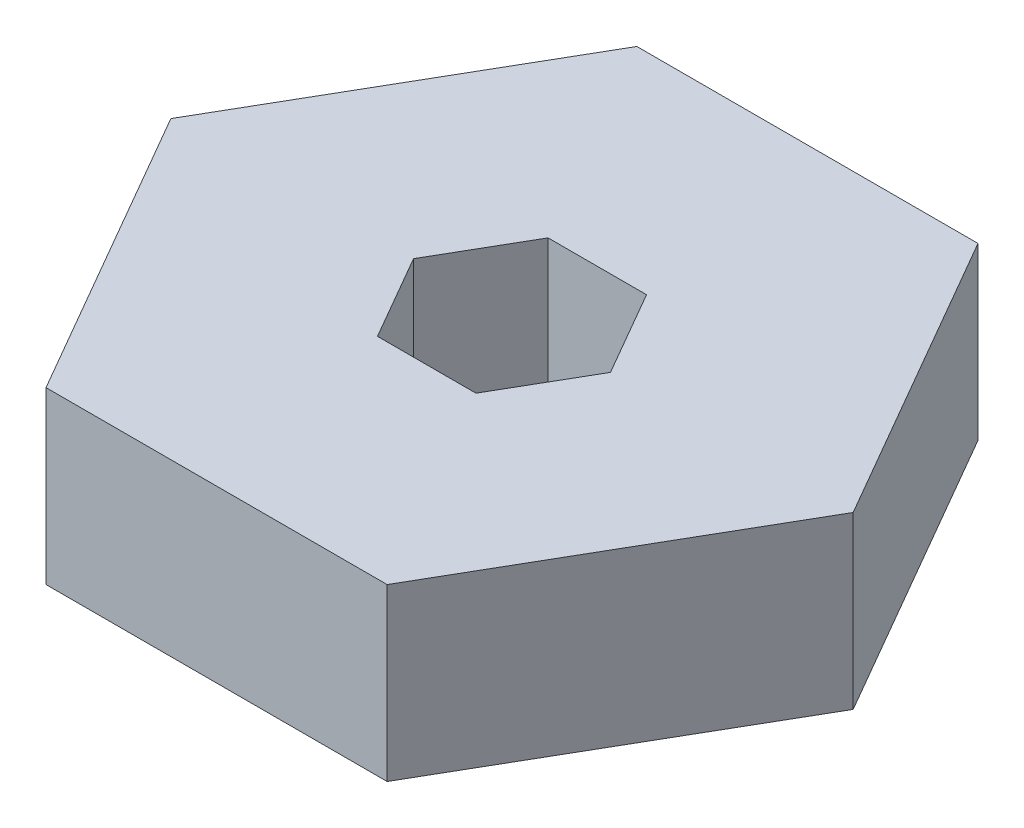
SolidWorks part; units mm, degrees
ref_plane "Front Plane" through (0, 0, 0) normal (0, 0, 1) x (1, 0, 0)
ref_plane "Top Plane" through (0, 0, 0) normal (0, 1, 0) x (1, 0, 0)
ref_plane "Right Plane" through (0, 0, 0) normal (1, 0, 0) x (0, 0, -1)
sketch "Sketch2" plane through (0, 0, 0) normal (0, 1, 0) x (1, 0, 0)
  line L1 (11.547, 0) -> (5.7735, 10)
  line L2 (5.7735, 10) -> (-5.7735, 10)
  line L3 (-5.7735, 10) -> (-11.547, 0)
  line L4 (-11.547, 0) -> (-5.7735, -10)
  line L5 (-5.7735, -10) -> (5.7735, -10)
  line L6 (5.7735, -10) -> (11.547, 0)
  line L7 (40, 0) -> (20, 34.641)
  line L8 (20, 34.641) -> (-20, 34.641)
  line L9 (-20, 34.641) -> (-40, 0)
  line L10 (-40, 0) -> (-20, -34.641)
  line L11 (-20, -34.641) -> (20, -34.641)
  line L12 (20, -34.641) -> (40, 0)
  circle A0 centre (0, 0) radius 10 construction
  circle A1 centre (0, 0) radius 34.641 construction
extrude "Boss-Extrude1" add sketch "Sketch2" along normal blind 20
sketch "Sketch27" plane through (30, 0, 17.3205) normal (0.866, 0, 0.5) x (0.5, 0, -0.866)
  text T0 "2"
sketch "Sketch28" plane through (8.6603, 0, 5) normal (-0.866, 0, -0.5) x (-0.5, 0, 0.866)
  line L0 (0, 0) -> (0, 20) construction
  line L1 (5.7735, 0) -> (-5.7735, 0) construction
  line L2 (5.7735, 20) -> (-5.7735, 20) construction
  line L3 (0, 10) -> (5.7735, 10) construction
  line L4 (5.7735, 20) -> (5.7735, 0) construction
